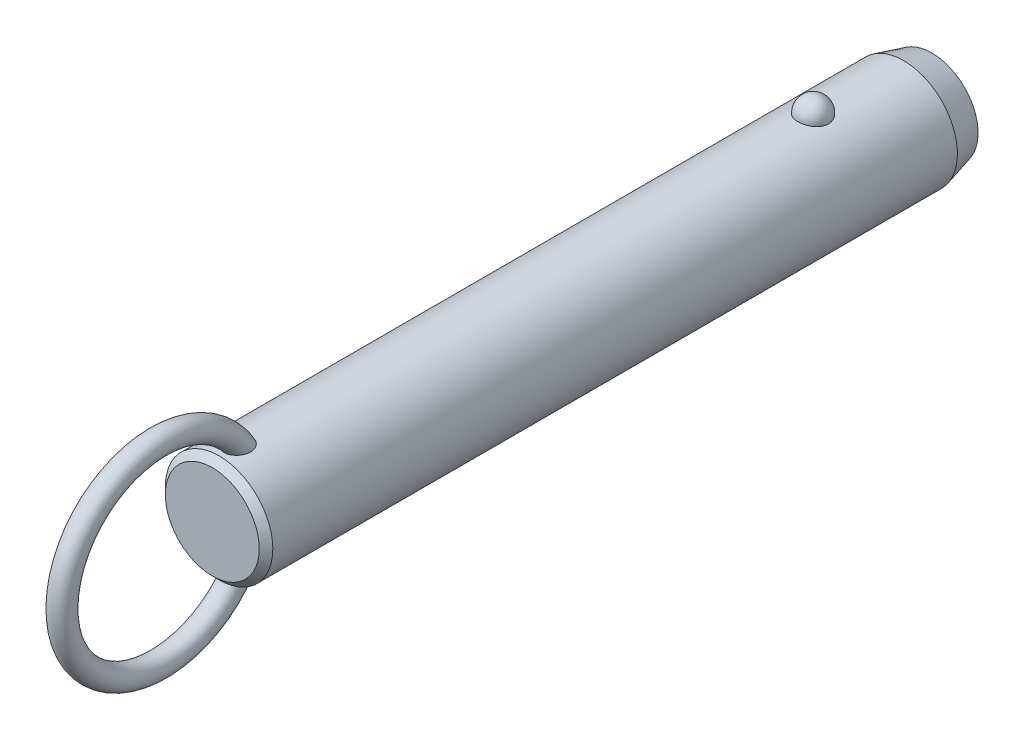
SolidWorks part; units mm, degrees
ref_plane "Front Plane" through (0, 0, 0) normal (0, 0, 1) x (1, 0, 0)
ref_plane "Top Plane" through (0, 0, 0) normal (0, 1, 0) x (1, 0, 0)
ref_plane "Right Plane" through (0, 0, 0) normal (1, 0, 0) x (0, 0, -1)
sketch "Sketch2" plane through (0, 0, 0) normal (0, 0, 1) x (1, 0, 0)
  circle A0 centre (0, 0) radius 9.5
  point P3 (0, 9.5)
  dimension "D1" = 19
extrude "Boss-Extrude1" add sketch "Sketch2" along normal blind 94
sketch "Sketch3" plane through (0, 0, 0) normal (0, 0, -1) x (-1, 0, 0)
  circle A0 centre (0, 0) radius 9.5
  dimension "D1" = 19
extrude "Boss-Extrude2" add sketch "Sketch3" along normal blind 23.7
chamfer "Chamfer1" distance 5 angle 15 1 edges at (-9.5, 0, -23.7)
sketch "Sketch12" plane through (0, 0, 0) normal (1, 0, 0) x (0, 0, -1)
  line L0 (-94, 9.5) -> (-94, -9.5) construction
  point P0 (-94, 0)
sketch "Sketch13" plane through (0, 0, 0) normal (1, 0, 0) x (0, 0, -1)
  circle A0 centre (-113.05, 0) radius 19.05
  point P2 (-94, 0)
  dimension "D1" = 38.1
sketch "Sketch14" plane through (0, 0, 0) normal (0, 1, 0) x (1, 0, 0)
  circle A0 centre (0, -96) radius 2
  point P2 (0, -94)
  dimension "D1" = 4
sweep "Sweep1" add profiles "Sketch14" path "Sketch13"
sketch "Sketch15" plane through (0, 0, 94) normal (0, 0, 1) x (1, 0, 0)
  circle A0 centre (0, 0) radius 9.5
  dimension "D1" = 19
extrude "Boss-Extrude3" add sketch "Sketch15" along normal blind 9.52
chamfer "Chamfer2" distance 1.2 angle 45 1 edges at (9.5, 0, 103.52)
sketch "Sketch18" plane through (0, 0, 0) normal (1, 0, 0) x (0, 0, -1)
  line L0 (18.7, 9.5) -> (-96.5378, 9.5) construction
  line L1 (2.7, 12.2) -> (2.7, 6.8)
  line L2 (-96.5378, -9.5) -> (18.7, -9.5) construction
  arc A0 (2.7, 12.2) -> (2.7, 6.8) centre (2.7, 9.5) ccw
  point P4 (0, 9.5)
  dimension "D1" = 21.7
revolve "Revolve1" add sketch "Sketch18" angle 360 about L1
